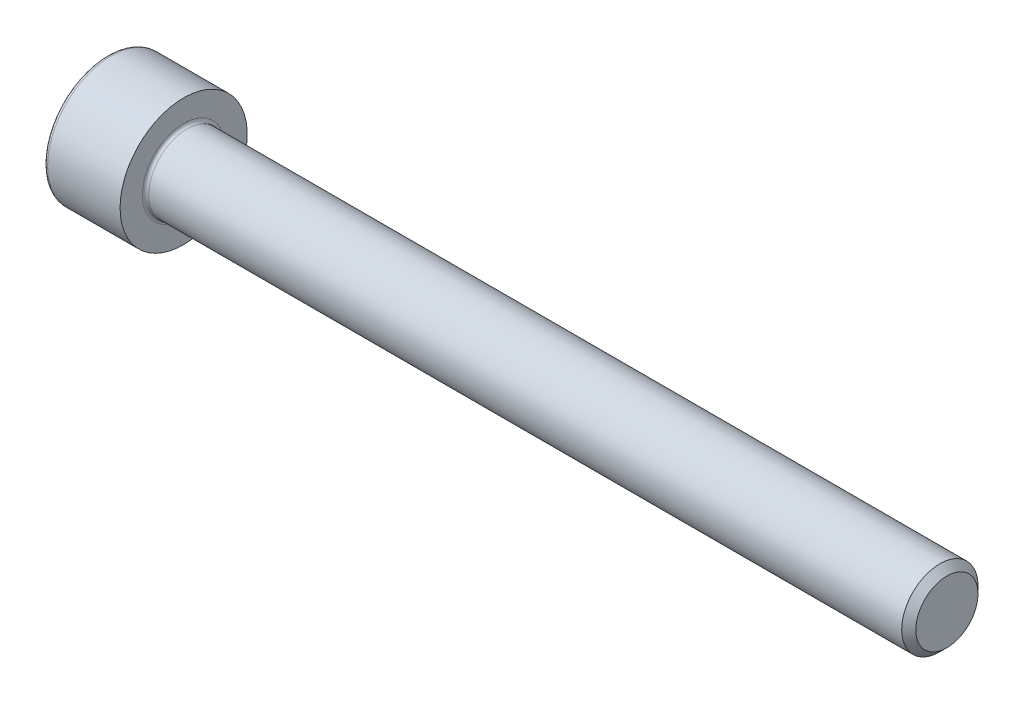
SolidWorks part; units mm, degrees
ref_plane "Plane1" through (0, 0, 0) normal (0, 0, 1) x (1, 0, 0)
ref_plane "Plane2" through (0, 0, 0) normal (0, 1, 0) x (1, 0, 0)
ref_plane "Plane3" through (0, 0, 0) normal (1, 0, 0) x (0, 0, -1)
revolve "Base-Revolve" add sketch "BodySke"
sketch "BodySke" plane through (0, 0, 0) normal (0, 0, 1) x (1, 0, 0)
  line L0 (0, 0) -> (0, 5)
  line L1 (0, 5) -> (6, 5)
  line L2 (6, 5) -> (6, 3)
  line L3 (6, 3) -> (65.4455, 3)
  line L4 (66, 2.4455) -> (66, 0)
  line L5 (66, 0) -> (0, 0)
  line L6 (-31.75, 0) -> (127, 0) construction
  line L8 (66, 2.4455) -> (65.4455, 3)
  line L10 (66, -2.4455) -> (65.4455, -3) construction
  line L11 (7, 9.525) -> (7, 3.175) construction
  line L12 (42, 9.525) -> (42, 3.175) construction
  line L13 (6, 9.525) -> (6, 3.175) construction
  dimension "Diameter" = 6
  dimension "Head_ht" = 6
  dimension "Length" = 60
  dimension "Body_ch_ang" = 45
  dimension "Head_dia" = 10
  dimension "Minor_dia" = 4.891
  dimension "Advance" = 1
  dimension "Thread_nom" = 24
  dimension "Thread_length" = 60
fillet "Fillet1" radius 0.25 1 edges at (6, 0, 3)
fillet "Fillet2" radius 0.3 1 edges at (0, 0, 5)
sketch "Sketch2" plane through (0, 0, 0) normal (0, 0, 1) x (1, 0, 0)
  line L0 (0, 2.542) -> (3, 2.542)
  line L1 (3, 2.542) -> (4.4676, 0)
  line L2 (-31.75, 0) -> (127, 0) construction
  line L3 (4.4676, 0) -> (0, 0)
  line L4 (0, 0) -> (0, 2.542)
  line L6 (0, 0) -> (47.625, 0) construction
  dimension "D1" = 2.542
  dimension "D2" = 60
  dimension "Depth" = 3
revolve "Hex-PreBroach" cut sketch "Sketch2" angle 360 about L6
sketch "Sketch3" plane through (0, 0, 0) normal (-1, 0, 0) x (0, 0.5, 0.866)
  line L0 (1.4676, 2.542) -> (-1.4676, 2.542)
  line L1 (-1.4676, 2.542) -> (-2.9352, 0)
  line L2 (1.4676, 2.542) -> (2.9352, 0)
  line L3 (1.4676, -2.542) -> (2.9352, 0)
  line L4 (1.4676, -2.542) -> (-1.4676, -2.542)
  line L5 (-1.4676, -2.542) -> (-2.9352, 0)
  dimension "D1" = 2.542
  dimension "D2" = 2.542
  dimension "Hex_size" = 5.084
extrude "Hex" cut sketch "Sketch3" against normal blind 3
sketch "ThdSchSke" plane through (0, 0, 0) normal (0, 0, 1) x (1, 0, 0)
  line L0 (42, -2.4455) -> (41.6117, -3)
  line L1 (42, -2.4455) -> (42.3883, -3)
  line L2 (42.3883, -3) -> (42.3883, -3.75)
  line L3 (-3.175, 0) -> (5.1513, 0) construction
  line L4 (0, 4.7) -> (0, -4.7) construction
  line L5 (42.3883, -3.75) -> (41.6117, -3.75)
  line L6 (41.6117, -3.75) -> (41.6117, -3)
  dimension "Thread_minor" = 4.891
  dimension "Diameter" = 6
  dimension "Start" = 42
  dimension "SideAngle" = 55
  dimension "VeeAngle" = 70
  dimension "Overcut" = 7.5
revolve "ThreadSchematic" [suppressed] cut sketch "ThdSchSke" angle 360 about L3
pattern_linear "ThdSchPat" [suppressed]
equation "\"D2@Sketch3\" = \"Hex_size@Sketch3\" / 2"
equation "\"D1@Sketch3\" = \"Hex_size@Sketch3\" / 2"
equation "\"D1@Sketch2\" = \"Hex_size@Sketch3\" / 2"
equation "\"Thread_minor@ThreadCosmetic\"  =  \"Minor_dia@BodySke\""
equation "\"Depth@Sketch2\" =  \"Key_eng@Hex\""
equation "\"Thread_length@ThreadCosmetic\" = ((sgn( (\"Length@BodySke\" - \"Advance@BodySke\" * 3.0) - \"Thread_nom@BodySke\" )-1)*( (\"Length@BodySke\" - \"Advance@BodySke\" * 3.0) - \"Thread_nom@BodySke\" ))/-2+ \"Thread_no"
equation "\"Thread_minor@ThdSchSke\" = \"Minor_dia@BodySke\""
equation "\"Diameter@ThdSchSke\" = \"Diameter@BodySke\""
equation "\"Overcut@ThdSchSke\" = \"Diameter@BodySke\" * 1.25"
equation "\"Start@ThdSchSke\" = \"Head_ht@BodySke\" + \"Length@BodySke\" - \"Thread_length@ThreadCosmetic\"  '---Non-countersunk---"
equation "\"Num_threads@ThdSchPat\" = int( \"Thread_length@ThreadCosmetic\" / \"Advance@BodySke\" + 0.999 )  + 1"
equation "\"Advance@ThdSchPat\" = \"Thread_length@ThreadCosmetic\" /  (\"Num_threads@ThdSchPat\" - 1) 'relax it"
equation "\"Num_threads@ThdSchPat\" = \"Num_threads@ThdSchPat\" - sgn( \"Num_threads@ThdSchPat\" - 1) '---chamfered tips only---"
